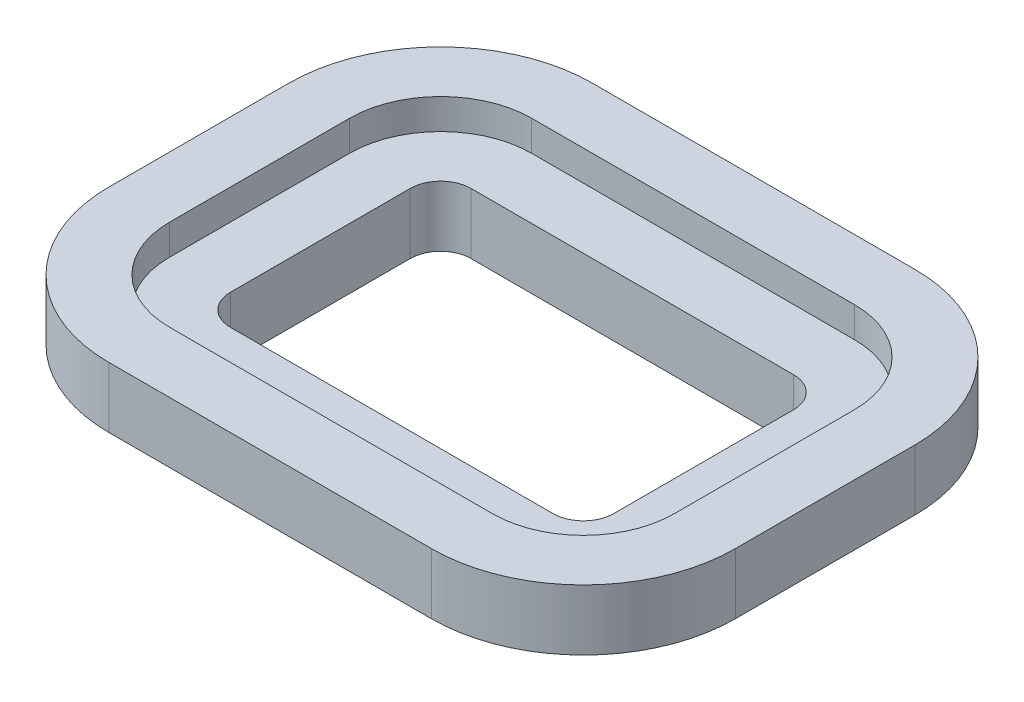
SolidWorks part; units mm, degrees
ref_plane "Front Plane" through (0, 0, 0) normal (0, 0, 1) x (1, 0, 0)
ref_plane "Top Plane" through (0, 0, 0) normal (0, 1, 0) x (1, 0, 0)
ref_plane "Right Plane" through (0, 0, 0) normal (1, 0, 0) x (0, 0, -1)
sketch "Sketch1" plane through (0, 0, 0) normal (0, 1, 0) x (1, 0, 0)
  line L1 (10, 0) -> (116.2087, 0)
  line L2 (0, 10) -> (0, 69.2069)
  line L3 (10, 79.2069) -> (116.2087, 79.2069)
  line L4 (126.2087, 10) -> (126.2087, 69.2069)
  arc A0 (10, 0) -> (0, 10) centre (10, 10) cw
  arc A1 (10, 79.2069) -> (0, 69.2069) centre (10, 69.2069) ccw
  arc A2 (116.2087, 79.2069) -> (126.2087, 69.2069) centre (116.2087, 69.2069) cw
  arc A3 (116.2087, 0) -> (126.2087, 10) centre (116.2087, 10) ccw
  point P7 (0, 0)
  dimension "D1" = 10
ref_plane "Plane1" through (116.2087, 0, 0) normal (1, 0, 0) x (0, 0, -1)
sketch "Sketch2" plane through (116.2087, 0, 0) normal (1, 0, 0) x (0, 0, -1)
  line L0 (0, 0) -> (0, -20)
  line L1 (0, -20) -> (-20, -20)
  line L2 (-20, -20) -> (-20, -10)
  line L3 (-20, -10) -> (-40, -10)
  line L4 (-40, -10) -> (-40, 10)
  line L5 (-40, 10) -> (-20, 10)
  line L6 (-20, 10) -> (-20, 0)
  line L7 (-20, 0) -> (0, 0)
  dimension "D1" = 20
  dimension "D2" = 20
  dimension "D3" = 10
sweep "Sweep1" add profiles "Sketch2" path "Sketch1"
